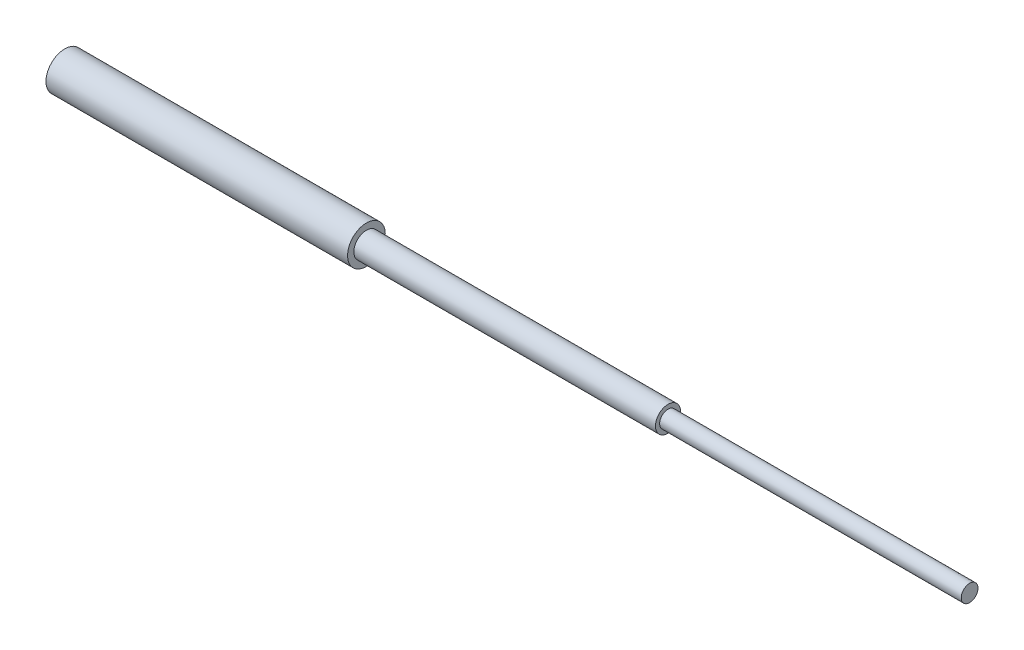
SolidWorks part; units mm, degrees
ref_plane "Front Plane" through (0, 0, 0) normal (0, 0, 1) x (1, 0, 0)
ref_plane "Top Plane" through (0, 0, 0) normal (0, 1, 0) x (1, 0, 0)
ref_plane "Right Plane" through (0, 0, 0) normal (1, 0, 0) x (0, 0, -1)
sketch "Sketch1" plane through (0, 0, 0) normal (1, 0, 0) x (0, 0, -1)
  circle A0 centre (0, 0) radius 28.575
  dimension "D1" = 57.15
extrude "Extrude1" add sketch "Sketch1" along normal blind 457.2
sketch "Sketch2" plane through (457.2, 0, 0) normal (1, 0, 0) x (0, 0, -1)
  circle A0 centre (0, 0) radius 19.05
  dimension "D1" = 38.1
extrude "Extrude2" add sketch "Sketch2" along normal blind 457.2
sketch "Sketch4" plane through (914.4, 0, 0) normal (1, 0, 0) x (0, 0, -1)
  circle A0 centre (0, 0) radius 12.7
  dimension "D1" = 25.4
extrude "Extrude3" add sketch "Sketch4" along normal blind 457.2
fillet "Fillet6" [suppressed] radius 3.175
